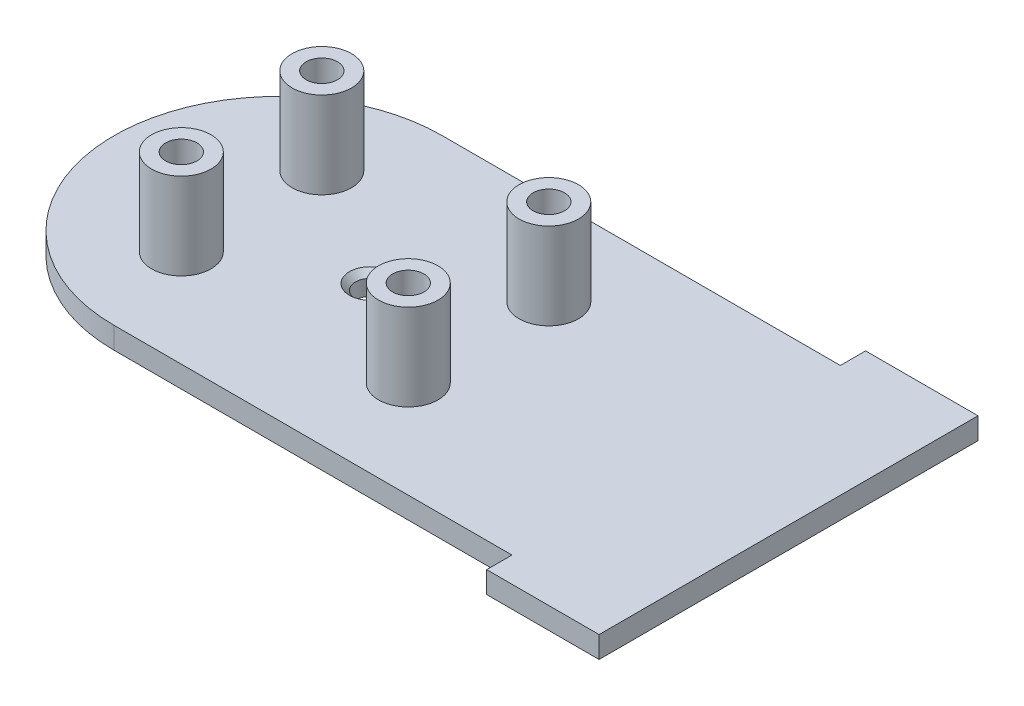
SolidWorks part; units mm, degrees
ref_plane "Front Plane" through (0, 0, 0) normal (0, 0, 1) x (1, 0, 0)
ref_plane "Top Plane" through (0, 0, 0) normal (0, 1, 0) x (1, 0, 0)
ref_plane "Right Plane" through (0, 0, 0) normal (1, 0, 0) x (0, 0, -1)
sketch "Base Shape Sketch" plane through (0, 0, 0) normal (0, 1, 0) x (1, 0, 0)
  line L0 (0, 15.19) -> (38.325, 15.19)
  line L2 (0, -15.19) -> (36.825, -15.19)
  line L5 (38.325, 15.19) -> (38.325, 17.5294)
  line L6 (38.325, 17.5294) -> (47.225, 17.5294)
  line L11 (47.225, -17.5294) -> (36.825, -17.5294)
  line L12 (36.825, -15.19) -> (36.825, -17.5294)
  line L14 (47.225, 17.5294) -> (47.225, -17.5294)
  arc A0 (0, 15.19) -> (0, -15.19) centre (0, 0) ccw
  dimension "D1" = 30.38
  dimension "D2" = 35.0589
  dimension "D3" = 2.3394
  dimension "D4" = 38.325
  dimension "D5" = 36.825
  dimension "D6" = 10.4
extrude "Base Shape" add sketch "Base Shape Sketch" along normal blind 2 contours L2 L12 L11 L14 L6 L5 L0 A0
sketch "Screw Hole Sketch" plane through (0, 2, 0) normal (0, 1, 0) x (1, 0, 0)
  circle A0 centre (8.5, 0) radius 1.35
  dimension "D1" = 2.7
  dimension "D2" = 8.5
extrude "Screw Hole" cut sketch "Screw Hole Sketch" against normal through all
sketch "Countersink Sketch" plane through (0, 0, 0) normal (0, 0, 1) x (1, 0, 0)
  line L0 (8.5, 2) -> (8.5, 0.8)
  line L1 (0, 2) -> (36.825, 2) construction
  line L2 (8.5, 0.8) -> (9.5, 0.8)
  line L3 (9.5, 0.8) -> (9.5, 1.1)
  line L4 (9.5, 1.1) -> (10.4, 2)
  line L5 (10.4, 2) -> (8.5, 2)
  dimension "D1" = 1.9
  dimension "D2" = 1.2
  dimension "D3" = 1
  dimension "D4" = 45
  dimension "D5" = 8.5
revolve "Screw Hole Countersink" cut sketch "Countersink Sketch" angle 360 about L0
sketch "PCB Cutout Sketch" plane through (0, 0, 0) normal (0, -1, 0) x (1, 0, 0)
  line L0 (-1.8189, -4.5) -> (-1.8189, 4.5) construction
  line L5 (-4.5, -6.5) -> (4.5, -6.5)
  line L6 (-4.5, -6.5) -> (-4.5, 4.5)
  line L7 (-4.5, 4.5) -> (4.5, 4.5)
  line L8 (4.5, -6.5) -> (4.5, 4.5)
  point P4 (0, -6.5)
  point P9 (-1.8189, 0)
  dimension "D1" = 11
  dimension "D2" = 9
  dimension "D3" = 9
extrude "Camera PCB Cutout" cut sketch "PCB Cutout Sketch" against normal blind 1.5
sketch "Ribbon Routing Sketch" plane through (4.5, 0, 0) normal (-1, 0, 0) x (0, 0, 1)
  line L0 (-6.5, 1.5) -> (-12.0981, 0)
  line L1 (-12.0981, 0) -> (-6.5, 0)
  line L2 (-6.5, 0) -> (-6.5, 1.5)
  line L3 (4.5, 0) -> (10.0981, 0)
  line L4 (4.5, 0) -> (4.5, 1.5)
  line L5 (-6.5, 1.5) -> (4.5, 1.5) construction
  line L6 (4.5, 1.5) -> (10.0981, 0)
  dimension "D1" = 75
extrude "Camera Ribbon Routing" cut sketch "Ribbon Routing Sketch" along normal up to surface (9 mm away)
sketch "草图1" plane through (0, 2, 0) normal (0, 1, 0) x (1, 0, 0)
  line L1 (47.225, 17.5294) -> (47.225, -17.5294) construction
  circle A0 centre (-2.775, 6.8169) radius 2.75
  circle A1 centre (18.225, 6.8169) radius 2.75
  circle A2 centre (-2.775, -6.1831) radius 2.75
  circle A3 centre (18.225, -6.1831) radius 2.75
  dimension "D5" = 5.5
  dimension "D6" = 5.5
  dimension "D7" = 5.5
  dimension "D8" = 5.5
  dimension "D1" = 29
  dimension "D2" = 21
  dimension "D3" = 0
  dimension "D4" = 0
extrude "凸台-拉伸1" add sketch "草图1" along normal blind 8
sketch "草图2" plane through (0, 10, 0) normal (0, 1, 0) x (1, 0, 0)
  circle A0 centre (-2.775, 6.8169) radius 1.45
  circle A1 centre (18.225, 6.8169) radius 1.45
  circle A2 centre (-2.775, -6.1831) radius 1.45
  circle A3 centre (18.225, -6.1831) radius 1.45
  circle A4 centre (-2.775, 6.8169) radius 2.75 construction
  circle A5 centre (18.225, 6.8169) radius 2.75 construction
  circle A6 centre (-2.775, -6.1831) radius 2.75 construction
  circle A7 centre (-2.775, -6.1831) radius 2.75 construction
  circle A8 centre (18.225, -6.1831) radius 2.75 construction
  dimension "D1" = 0
  dimension "D2" = 0
  dimension "D3" = 0
  dimension "D4" = 0
  dimension "D5" = 0
extrude "切除-拉伸1" cut sketch "草图2" against normal blind 5
other "移动面1" parameters "D1"=1.5
